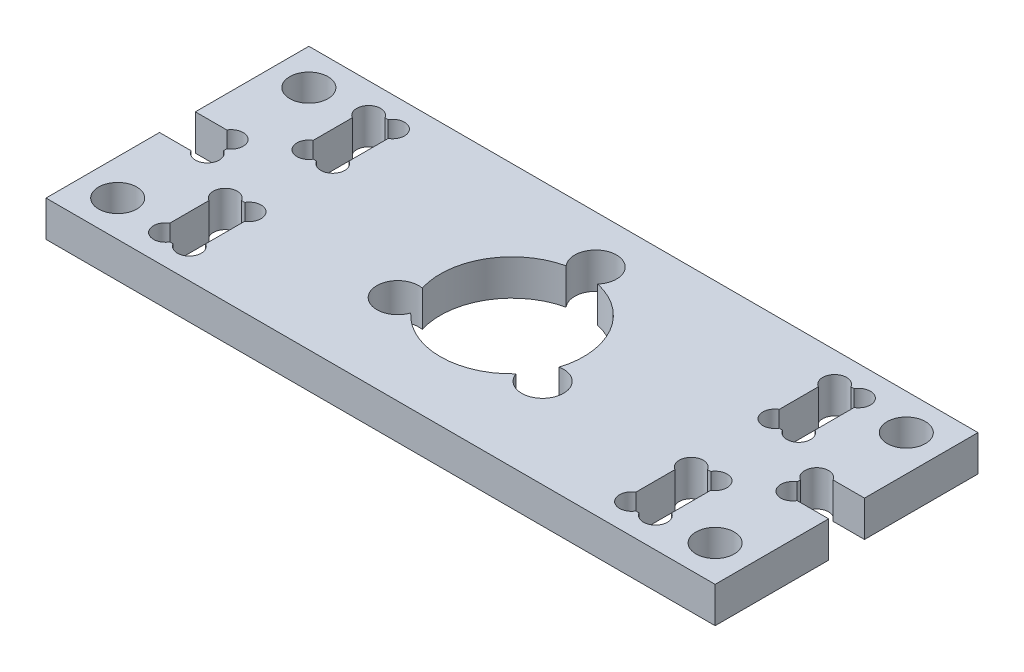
SolidWorks part; units mm, degrees
ref_plane "前视基准面" through (0, 0, 0) normal (0, 0, 1) x (1, 0, 0)
ref_plane "上视基准面" through (0, 0, 0) normal (0, 1, 0) x (1, 0, 0)
ref_plane "右视基准面" through (0, 0, 0) normal (1, 0, 0) x (0, 0, -1)
sketch "草图1" plane through (0, 0, 0) normal (0, 1, 0) x (1, 0, 0)
  line L1 (-28, -11) -> (28, -11)
  line L2 (-28, -11) -> (-28, 11)
  line L3 (-28, 11) -> (28, 11)
  line L4 (28, -11) -> (28, 11)
  line L5 (-28, -11) -> (28, 11) construction
  line L6 (-28, 11) -> (28, -11) construction
  point P0 (0, 0)
  dimension "D1" = 22
  dimension "D2" = 56
extrude "凸台-拉伸1" add sketch "草图1" along normal blind 3
hole_wizard "Ø3.2 (3.2) 直径孔1" positions "草图2" profile "草图3" hole size "Ø3.2" standard "GB"
sketch "草图2" plane through (0, 3, 0) normal (0, 1, 0) x (1, 0, 0)
  line L0 (0, 11) -> (0, -11) construction
  line L1 (28, 11) -> (-28, 11) construction
  line L2 (-28, -11) -> (28, -11) construction
  line L4 (-28, 0) -> (28, 0) construction
  line L5 (-28, 11) -> (-28, -11) construction
  line L6 (28, -11) -> (28, 11) construction
  point P16 (-25, 8)
  point P19 (25, 8)
  point P20 (25, -8)
  point P21 (-25, -8)
  dimension "D1" = 50
  dimension "D2" = 16
sketch "草图3" plane through (-25, 3, 8) normal (1, 0, 0) x (0, 0, 1)
  line L0 (0, 0) -> (0, 3)
  line L1 (0, 3) -> (1.6, 3)
  line L2 (1.6, 3) -> (1.6, 0)
  line L5 (1.6, 0) -> (0, 0)
  line L11 (0, -6.35) -> (0, 107.95) construction
  dimension "通孔孔直径" = 3.2
  dimension "通孔孔深度" = 3
sketch "草图4" plane through (0, 3, 0) normal (0, 1, 0) x (1, 0, 0)
  circle A0 centre (0, 0) radius 6
  dimension "D1" = 12
extrude "切除-拉伸1" cut sketch "草图4" against normal through all
sketch "草图5" plane through (0, 3, 0) normal (0, 1, 0) x (1, 0, 0)
  line L0 (0, 11) -> (0, -11) construction
  line L1 (28, 11) -> (-28, 11) construction
  line L2 (-28, -11) -> (28, -11) construction
  line L3 (-28, 0) -> (28, 0) construction
  line L4 (-21, 9) -> (-18, 9)
  line L5 (-21, 9) -> (-21, 3)
  line L6 (-21, 3) -> (-18, 3)
  line L7 (-18, 9) -> (-18, 3)
  line L8 (-28, 11) -> (-28, -11) construction
  line L9 (28, -11) -> (28, 11) construction
  line L10 (-18, -9) -> (-18, -3)
  line L11 (-21, -3) -> (-18, -3)
  line L12 (-21, -9) -> (-21, -3)
  line L13 (-21, -9) -> (-18, -9)
  line L14 (21, -9) -> (18, -9)
  line L15 (21, -9) -> (21, -3)
  line L16 (21, -3) -> (18, -3)
  line L17 (18, -9) -> (18, -3)
  line L18 (18, 9) -> (18, 3)
  line L19 (21, 3) -> (18, 3)
  line L20 (21, 9) -> (21, 3)
  line L21 (21, 9) -> (18, 9)
  line L22 (24, 1.5) -> (24, -1.5)
  line L23 (-28, 1.5) -> (-24, 1.5)
  line L24 (-28, 1.5) -> (-28, -1.5)
  line L25 (-28, -1.5) -> (-24, -1.5)
  line L26 (-24, 1.5) -> (-24, -1.5)
  line L27 (28, -1.5) -> (24, -1.5)
  line L28 (28, 1.5) -> (28, -1.5)
  line L29 (28, 1.5) -> (24, 1.5)
  dimension "D1" = 6
  dimension "D2" = 6
  dimension "D3" = 7
  dimension "D4" = 3
  dimension "D5" = 3
  dimension "D6" = 4
extrude "切除-拉伸2" cut sketch "草图5" against normal through all
hole_wizard "Ø2.0 (2) 直径孔1" positions "草图8" profile "草图9" hole size "Ø2.0" standard "GB"
sketch "草图8" plane through (0, 3, 0) normal (0, 1, 0) x (1, 0, 0)
  line L0 (-24, 0) -> (24, 0) construction
  line L1 (-24, -1.5) -> (-24, 1.5) construction
  line L2 (24, 1.5) -> (24, -1.5) construction
  line L4 (0, 11) -> (0, -11) construction
  line L5 (28, 11) -> (-28, 11) construction
  line L6 (-28, -11) -> (28, -11) construction
  line L7 (-18, 9) -> (-21, 9) construction
  line L8 (-21, 9) -> (-21, 3) construction
  line L9 (-19.5, 9) -> (-19.5, 3) construction
  line L10 (-21, 3) -> (-18, 3) construction
  line L12 (-21, 6) -> (-18, 6) construction
  line L13 (-18, 3) -> (-18, 9) construction
  line L14 (-24, 1.5) -> (-28, 1.5) construction
  point P50 (-20.5, 8.5)
  point P71 (-18.5, 8.5)
  point P72 (-18.5, 3.5)
  point P73 (-20.5, 3.5)
  point P74 (-24.5, 1)
  point P79 (-24.5, -1)
  point P80 (-20.5, -3.5)
  point P81 (-18.5, -3.5)
  point P83 (-18.5, -8.5)
  point P84 (-20.5, -8.5)
  point P85 (24.5, -1)
  point P86 (24.5, 1)
  point P87 (20.5, -8.5)
  point P88 (18.5, -8.5)
  point P89 (18.5, -3.5)
  point P90 (20.5, -3.5)
  point P91 (20.5, 3.5)
  point P92 (18.5, 3.5)
  point P93 (18.5, 8.5)
  point P94 (20.5, 8.5)
  dimension "D1" = 0.5
  dimension "D2" = 0.5
  dimension "D3" = 0.5
  dimension "D4" = 0.5
sketch "草图9" plane through (20.5, 3, -8.5) normal (1, 0, 0) x (0, 0, 1)
  line L0 (0, 0) -> (0, 3)
  line L1 (0, 3) -> (1, 3)
  line L2 (1, 3) -> (1, 0)
  line L5 (1, 0) -> (0, 0)
  line L11 (0, -6.35) -> (0, 107.95) construction
  dimension "通孔孔直径" = 2
  dimension "通孔孔深度" = 3
hole_wizard "Ø3.5 (3.5) 直径孔1" positions "草图10" profile "草图11" hole size "Ø3.5" standard "GB"
sketch "草图10" plane through (0, 3, 0) normal (0, 1, 0) x (1, 0, 0)
  circle A0 centre (0, 0) radius 7 construction
  point P5 (0, 7)
  point P13 (6.0622, -3.5)
  point P14 (-6.0622, -3.5)
  dimension "D1" = 14
  dimension "D2" = 3
sketch "草图11" plane through (-6.0622, 3, 3.5) normal (1, 0, 0) x (0, 0, 1)
  line L0 (0, 0) -> (0, 3)
  line L1 (0, 3) -> (1.75, 3)
  line L2 (1.75, 3) -> (1.75, 0)
  line L5 (1.75, 0) -> (0, 0)
  line L11 (0, -6.35) -> (0, 107.95) construction
  dimension "通孔孔直径" = 3.5
  dimension "通孔孔深度" = 3
